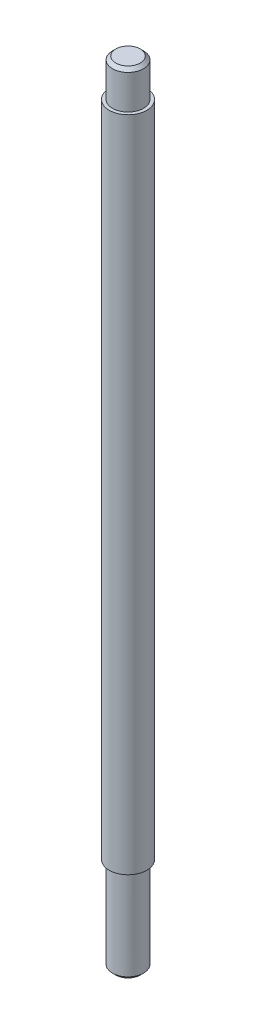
SolidWorks part; units mm, degrees
ref_plane "Front Plane" through (0, 0, 0) normal (0, 0, 1) x (1, 0, 0)
ref_plane "Top Plane" through (0, 0, 0) normal (0, 1, 0) x (1, 0, 0)
ref_plane "Right Plane" through (0, 0, 0) normal (1, 0, 0) x (0, 0, -1)
sketch "Sketch1" plane through (0, 0, 0) normal (0, 1, 0) x (1, 0, 0)
  circle A0 centre (0, 0) radius 2
  dimension "D1" = 4
extrude "Extrude1" add sketch "Sketch1" along normal blind 84
sketch "Sketch2" plane through (0, 84, 0) normal (0, 1, 0) x (1, 0, 0)
  circle A0 centre (0, 0) radius 6.0248
  circle A1 centre (0, 0) radius 1.65
  dimension "D1" = 3.3
extrude "Extrude2" cut sketch "Sketch2" against normal blind 4
sketch "Sketch3" plane through (0, 0, 0) normal (0, -1, 0) x (1, 0, 0)
  circle A0 centre (0, 0) radius 4.0467
  circle A1 centre (0, 0) radius 1.65
  dimension "D1" = 3.3
extrude "Extrude3" cut sketch "Sketch3" against normal blind 10
chamfer "Chamfer1" distance 0.35 angle 45 2 edges at (0, 84, 1.65) (0, 0, -1.65)
